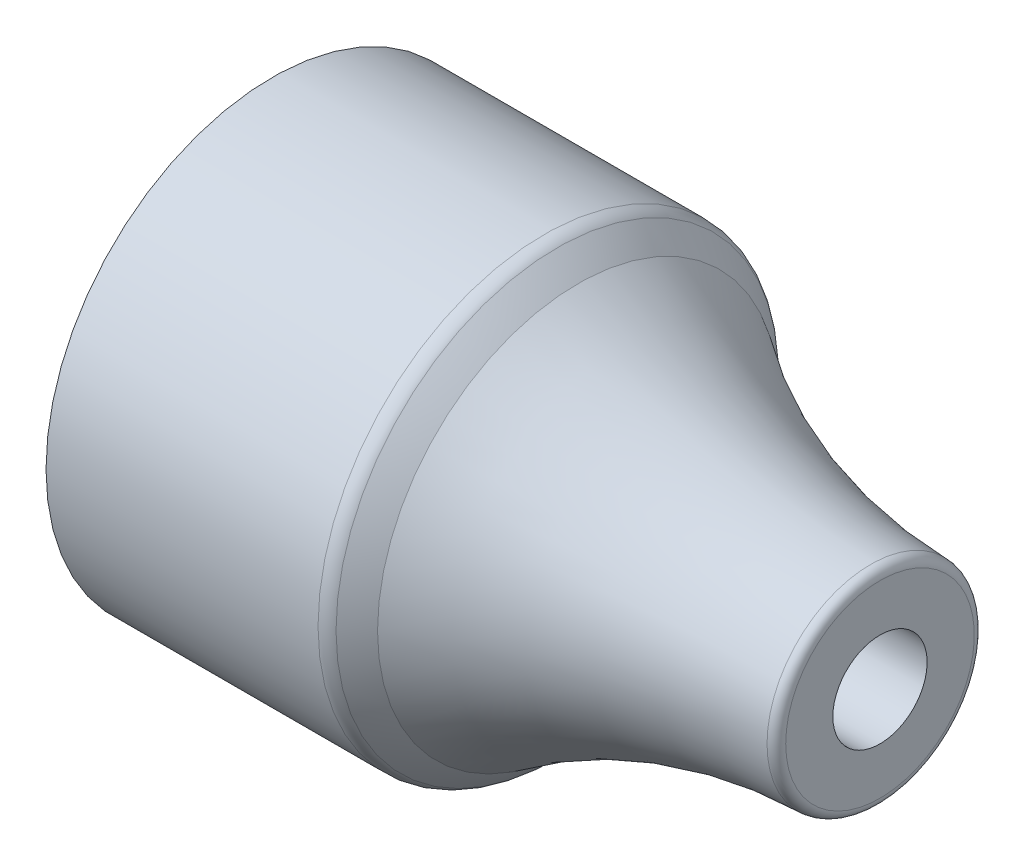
SolidWorks part; units mm, degrees
ref_plane "Front Plane" through (0, 0, 0) normal (0, 0, 1) x (1, 0, 0)
ref_plane "Top Plane" through (0, 0, 0) normal (0, 1, 0) x (1, 0, 0)
ref_plane "Right Plane" through (0, 0, 0) normal (1, 0, 0) x (0, 0, -1)
sketch "Sketch2" plane through (0, 0, 0) normal (0, 0, 1) x (1, 0, 0)
  line L0 (-71.7746, 0) -> (6.4266, 0) construction
  line L1 (10, 5) -> (10, 10.0002)
  line L2 (-25.6027, 24) -> (-54.45, 24)
  line L3 (-54.45, 24) -> (-54.45, 23.5)
  line L4 (-54.45, 23.5) -> (-51.45, 23.5)
  line L5 (-55.9164, 22.2278) -> (-55.9164, 0.5) construction
  line L6 (9, 6) -> (9, 9.0263)
  line L7 (-26, 23) -> (-51.45, 23)
  line L8 (-55.9164, 0.5) -> (9, 0.5) construction
  line L9 (9, 0.5) -> (9, 10.0002) construction
  line L10 (10, -0.5) -> (10, 10.9912) construction
  line L11 (-56.9164, -0.5) -> (10, -0.5) construction
  line L12 (-51.45, 23.5) -> (-51.45, 23)
  line L14 (-24.82, 24) -> (-54.45, 24) construction
  line L15 (-56.9164, 22.3951) -> (-56.9164, -0.5) construction
  line L16 (-25.2094, 23) -> (-54.5232, 23) construction
  line L17 (9, 6) -> (-1, 6)
  line L18 (-1, 6) -> (-1, 0)
  line L19 (-1, 0) -> (0, 0)
  line L20 (0, 0) -> (0, 5)
  line L21 (0, 5) -> (10, 5)
  arc A0 (9.0179, 11) -> (-22.0189, 21.2722) centre (10, 65.9912) cw
  arc A1 (-22.0189, 21.2722) -> (-24.2353, 23.4595) centre (-65.2577, -20.3259) ccw
  arc A2 (-22.0189, 21.2722) -> (-24.82, 24) centre (-65.2577, -20.3259) ccw construction
  arc A3 (8.0351, 10.0257) -> (-22.6764, 20.5132) centre (10, 65.9912) cw
  arc A4 (-22.6764, 20.5132) -> (-24.6225, 22.45) centre (-65.2577, -20.3259) ccw
  arc A5 (-24.2353, 23.4595) -> (-25.6027, 24) centre (-25.6027, 22) ccw
  arc A6 (10, 10.9912) -> (-22.0189, 21.2722) centre (10, 65.9912) cw construction
  arc A7 (10, 10.0002) -> (9.0179, 11) centre (9, 10.0002) ccw
  arc A8 (9, 10.0002) -> (-22.6764, 20.5132) centre (10, 65.9912) cw construction
  arc A9 (8.0351, 10.0257) -> (9, 9.0263) centre (8, 9.0263) cw
  arc A10 (-54.5232, 23) -> (-55.9164, 22.2278) centre (-54.7394, 21.747) ccw construction
  arc A11 (-54.45, 24) -> (-56.9164, 22.3951) centre (-54.7394, 21.747) ccw construction
  arc A12 (-22.6764, 20.5132) -> (-25.2094, 23) centre (-65.2577, -20.3259) ccw construction
  arc A13 (-24.6225, 22.45) -> (-26, 23) centre (-26, 21) ccw
  point P26 (10, 10.9912)
  dimension "D3" = 10
  dimension "D6" = 55
  dimension "D7" = 60
  dimension "D8" = 1
  dimension "D2" = 3
  dimension "D9" = 1
  dimension "D10" = 1
  dimension "D11" = 2
  dimension "D1" = 0.5
  dimension "D4" = 24
  dimension "D5" = 1
  dimension "D12" = 6
  dimension "D13" = 64.45
  dimension "D14" = 25
  dimension "D15" = 11
revolve "Revolve1" add sketch "Sketch2" angle 360 about L0
sketch "Sketch13" plane through (0, 0, 0) normal (1, 0, 0) x (0, 0, -1)
  circle A0 centre (0, 0) radius 3
  dimension "D1" = 6
extrude "Extrude12" cut sketch "Sketch13" against normal blind 15
sketch "Sketch14" plane through (-1, 0, 0) normal (-1, 0, 0) x (0, 0, 1)
  circle A0 centre (0, 0) radius 4
  circle A1 centre (0, 0) radius 3
  dimension "D1" = 6
  dimension "D2" = 8
extrude "Extrude13" add sketch "Sketch14" along normal blind 10
